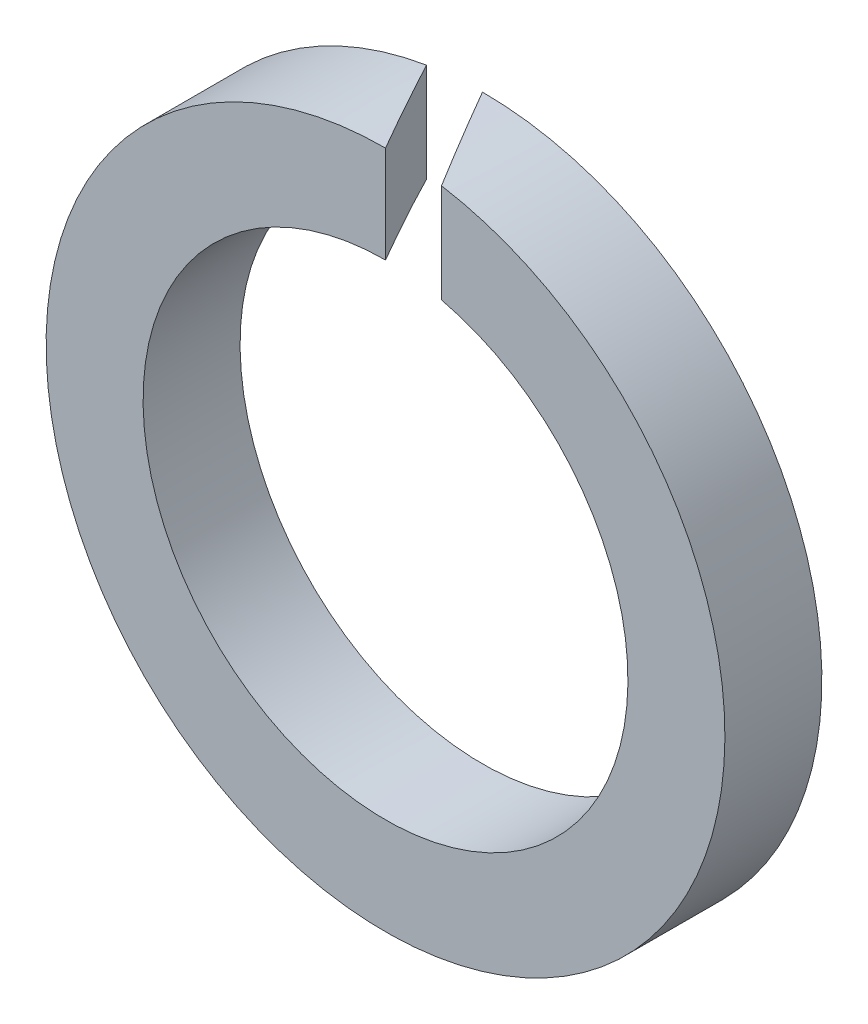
SolidWorks part; units mm, degrees
ref_plane "Front" through (0, 0, 0) normal (0, 0, 1) x (1, 0, 0)
ref_plane "Top" through (0, 0, 0) normal (0, 1, 0) x (1, 0, 0)
ref_plane "Right" through (0, 0, 0) normal (1, 0, 0) x (0, 0, -1)
other "Configuration Table"
sketch "Sketch1" plane through (0, 0, 0) normal (0, 0, 1) x (1, 0, 0)
  circle A0 centre (0, 0) radius 1.5
  circle A1 centre (0, 0) radius 2.1
  dimension "d" = 3
  dimension "b" = 0.6
extrude "Base-Extrude" add sketch "Sketch1" against normal blind 0.6
sketch "Sketch2" plane through (0, 0, 0) normal (0, 1, 0) x (1, 0, 0)
  line L0 (0, 0.6) -> (0.3464, 0)
  line L1 (0.3464, 0) -> (0, 0)
  line L3 (0, 0) -> (-0.3464, 0.6)
  line L5 (-0.3464, 0.6) -> (0, 0.6)
  line L7 (2.1, 0.6) -> (-2.1, 0.6) construction
  dimension "m" = 0.3
extrude "Cut-Extrude1" cut sketch "Sketch2" along normal through all
